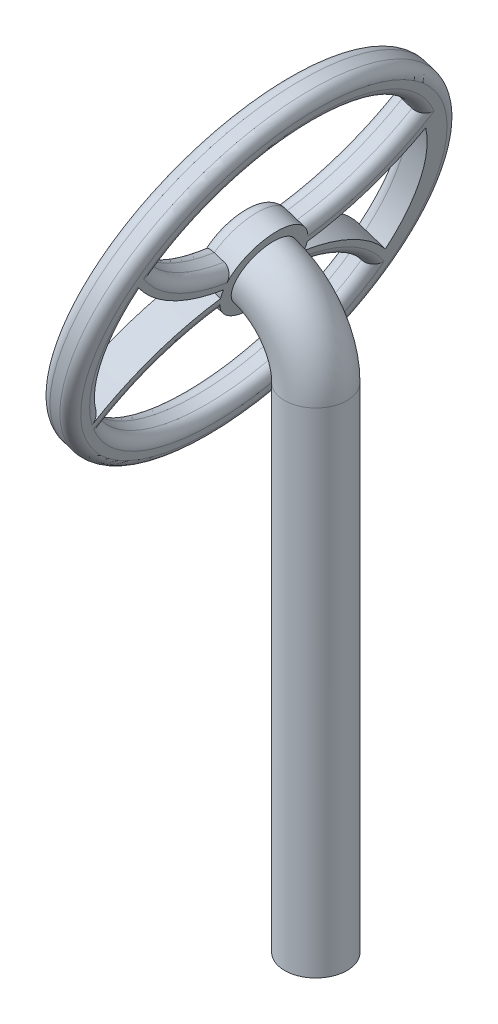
SolidWorks part; units mm, degrees
ref_plane "Front" through (0, 0, 0) normal (0, 0, 1) x (1, 0, 0)
ref_plane "Top" through (0, 0, 0) normal (0, 1, 0) x (1, 0, 0)
ref_plane "Right" through (0, 0, 0) normal (1, 0, 0) x (0, 0, -1)
sketch "Sketch1" plane through (0, 0, 0) normal (0, 0, 1) x (1, 0, 0)
  line L0 (0, 0) -> (0, 23.7019)
  arc A0 (0, 23.7019) -> (-2.4959, 27.1279) centre (-3.5995, 23.7019) ccw
sketch "Sketch3" plane through (0, 0, 0) normal (0, 1, 0) x (1, 0, 0)
  circle A0 centre (0, 0) radius 1.5
sweep "Sweep1" add profiles "Sketch3" path "Sketch1"
sketch "Sketch4" plane through (-10.1781, 3.2785, 0) normal (-0.9518, 0.3066, 0) x (0, 0, 1)
  circle A0 centre (0, 25.0562) radius 8.9113
  arc A1 (-6.376, 21.1098) -> (6.376, 21.1098) centre (0, 25.0562) ccw
  arc A2 (-2.0066, 25.285) -> (-2.0066, 24.8273) centre (0, 25.0562) ccw
  arc A3 (-6.376, 29.0025) -> (-1.7429, 26.0765) centre (0, 33.9675) ccw
  arc A4 (-6.8025, 28.211) -> (-2.0066, 25.285) centre (0, 33.9675) ccw
  arc A5 (-6.376, 21.1098) -> (-1.7429, 24.0358) centre (0, 16.1448) cw
  arc A6 (-6.8025, 21.9013) -> (-2.0066, 24.8273) centre (0, 16.1448) cw
  arc A7 (6.8025, 21.9013) -> (6.8025, 28.211) centre (0, 25.0562) ccw
  arc A8 (-6.8025, 28.211) -> (-6.8025, 21.9013) centre (0, 25.0562) ccw
  arc A9 (6.376, 29.0025) -> (-6.376, 29.0025) centre (0, 25.0562) ccw
  arc A10 (1.7429, 26.0765) -> (6.376, 29.0025) centre (0, 33.9675) ccw
  arc A11 (1.7429, 26.0765) -> (-1.7429, 26.0765) centre (0, 25.0562) ccw
  arc A12 (2.0066, 25.285) -> (6.8025, 28.211) centre (0, 33.9675) ccw
  arc A13 (2.0066, 24.8273) -> (6.8025, 21.9013) centre (0, 16.1448) cw
  arc A14 (2.0066, 24.8273) -> (2.0066, 25.285) centre (0, 25.0562) ccw
  arc A15 (-1.7429, 24.0358) -> (1.7429, 24.0358) centre (0, 25.0562) ccw
  arc A16 (1.7429, 24.0358) -> (6.376, 21.1098) centre (0, 16.1448) cw
extrude "Extrude1" add sketch "Sketch4" along normal blind 1.5
fillet "Fillet1" radius 0.5 2 edges at (-6.6558, 19.1057, 0) (-5.2281, 18.6458, 0)
fillet "Fillet2" radius 0.5 8 edges at (-6.2227, 20.4505, 0) (-4.5609, 25.6093, 4.315) (-4.5428, 25.6655, 0) (-4.5609, 25.6093, -4.315) (-3.2863, 29.5664, -4.315) (-3.3044, 29.5102, 0) (-3.2863, 29.5664, 4.315) (-1.6246, 34.7252, 0)
fillet "Fillet5" radius 0.5 7 edges at (-4.7949, 19.9906, 0) (-3.1332, 25.1494, 4.315) (-1.8585, 29.1065, 4.315) (-0.1968, 34.2653, 0) (-2.4959, 27.1279, 7.4985) (-3.9236, 27.5879, 7.4985) (-3.9236, 27.5879, -7.4985)
fillet "Fillet6" radius 0.5 1 edges at (-3.1783, 25.0092, -4.5398)
fillet "Fillet7" radius 0.5 1 edges at (-1.8134, 29.2467, -4.5398)
